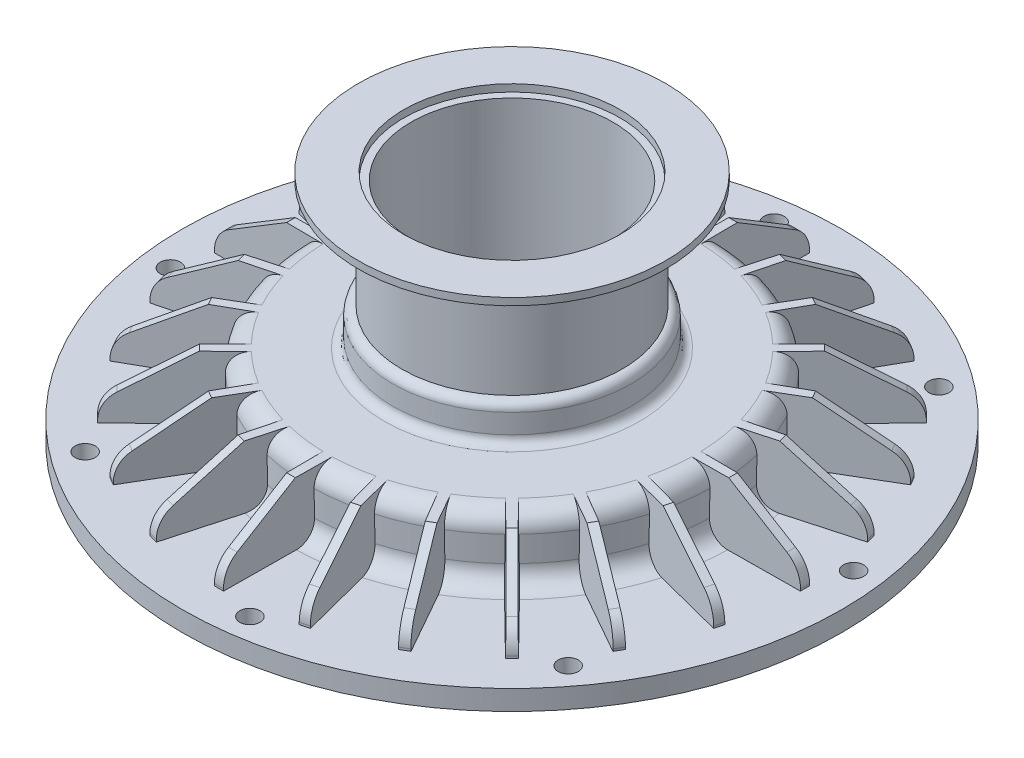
SolidWorks part; units mm, degrees
ref_plane "Ön Düzlem" through (0, 0, 0) normal (0, 0, 1) x (1, 0, 0)
ref_plane "Üst Düzlem" through (0, 0, 0) normal (0, 1, 0) x (1, 0, 0)
ref_plane "Sağ Düzlem" through (0, 0, 0) normal (1, 0, 0) x (0, 0, -1)
sketch "Çizim1" plane through (0, 0, 0) normal (1, 0, 0) x (0, 0, -1)
  line L0 (0, 0) -> (0, 56.1194) construction
  line L1 (-10, 35.35) -> (-70.25, 35.35)
  line L2 (-70.25, 35.35) -> (-70.25, 13.85)
  line L3 (-70.25, 13.85) -> (-114.25, 13.85)
  line L4 (-114.25, 13.85) -> (-114.25, 6.925)
  line L5 (-114.25, 6.925) -> (-101.55, 6.925)
  line L6 (-101.55, 6.925) -> (-101.55, 0)
  line L7 (-101.55, 0) -> (-20.05, 0)
  line L8 (-20.05, 0) -> (-20.05, 6.35)
  line L9 (-20.05, 6.35) -> (-16.88, 6.35)
  line L10 (-16.88, 6.35) -> (-16.88, 25.35)
  line L11 (-16.88, 25.35) -> (-10, 25.35)
  line L12 (-10, 25.35) -> (-10, 35.35)
  dimension "D1" = 10
  dimension "D2" = 60.25
  dimension "D3" = 21.5
  dimension "D4" = 10
  dimension "D5" = 19
  dimension "D6" = 6.35
  dimension "D7" = 81.5
  dimension "D8" = 44
  dimension "D9" = 12.7
  dimension "D10" = 3.17
revolve "Döndür1" add sketch "Çizim1" angle 360 about L0
sketch "Çizim2" plane through (0, 13.85, 0) normal (0, 1, 0) x (1, 0, 0)
  line L0 (0, 0) -> (114.25, 0) construction
  line L1 (0, 0) -> (113.2726, 14.9126) construction
  circle A0 centre (104.5974, 13.7705) radius 3.5
  circle A1 centre (0, 0) radius 114.25 construction
  dimension "D1" = 7
  dimension "D2" = 7.5
  dimension "D3" = 105.5
extrude "Kes-Ekstrüzyon1" cut sketch "Çizim2" against normal through all
pattern_circular "Dairesel Kaplama1" count 8 over 360 about axis through (0, 0, 0) along (0, 1, 0) of "Kes-Ekstrüzyon1"
fillet "Radyus1" radius 6.35 2 edges at (0, 13.85, -70.25) (0, 35.35, -70.25)
sketch "Çizim3" plane through (0, 0, 0) normal (0, 0, 1) x (1, 0, 0)
  line L0 (70.25, 20.2) -> (70.25, 29) construction
  line L1 (70.25, 20.2) -> (70.25, 29) construction
  line L2 (63.9, 35.35) -> (76.6, 35.35)
  line L3 (76.6, 35.35) -> (101.55, 20.2)
  line L4 (101.55, 20.2) -> (101.55, 13.85)
  line L5 (114.25, 13.85) -> (-114.25, 13.85) construction
  line L6 (101.55, 13.85) -> (76.6, 13.85) construction
  line L7 (114.25, 6.925) -> (114.25, 13.85) construction
  arc A0 (70.25, 29) -> (63.9, 35.35) centre (63.9, 29) ccw construction
  arc A1 (70.25, 20.2) -> (76.6, 13.85) centre (76.6, 20.2) ccw construction
  arc A2 (70.25, 29) -> (63.9, 35.35) centre (63.9, 29) ccw construction
  arc A3 (70.25, 20.2) -> (76.6, 13.85) centre (76.6, 20.2) ccw construction
  dimension "D1" = 6.35
  dimension "D2" = 12.7
  dimension "D3" = 12.7
rib "Feder1" sketch "Çizim3" sketch "Çizim3" thickness 3 extrusion direction parallel to sketch draft on yes draft angle 1 parameters "D1"=3, "D3"=1
fillet "Radyus2" radius 10 1 edges at (101.55, 20.2, 0)
pattern_circular "Dairesel Kaplama2" count 24 over 360 about axis through (0, 0, 0) along (0, 1, 0) of "Radyus2", "Feder1"
sketch "Çizim4" plane through (0, 35.35, 0) normal (0, 1, 0) x (1, 0, 0)
  circle A0 centre (0, 0) radius 41.25
  dimension "D1" = 82.5
extrude "Yükseklik-Ekstrüzyon1" add sketch "Çizim4" along normal blind 12.7
fillet "Radyus3" radius 3 2 edges at (0, 35.35, -41.25) (0, 48.05, 41.25)
sketch "Çizim5" plane through (0, 48.05, 0) normal (0, 1, 0) x (1, 0, 0)
  circle A0 centre (0, 0) radius 35
  dimension "D1" = 70
extrude "Kes-Ekstrüzyon2" cut sketch "Çizim5" against normal through all
sketch "Çizim6" plane through (0, 0, 0) normal (0, -1, 0) x (1, 0, 0)
  circle A0 centre (0, 0) radius 56.8
  dimension "D1" = 113.6
extrude "Kes-Ekstrüzyon3" cut sketch "Çizim6" against normal blind 25.4
sketch "Çizim7" plane through (0, 48.05, 0) normal (0, 1, 0) x (1, 0, 0)
  circle A0 centre (0, 0) radius 38.25 construction
  circle A1 centre (0, 0) radius 38.25
  circle A2 centre (0, 0) radius 35 construction
  circle A3 centre (0, 0) radius 35
extrude "Yükseklik-Ekstrüzyon2" add sketch "Çizim7" along normal blind 40
sketch "Çizim8" plane through (0, 0, 0) normal (1, 0, 0) x (0, 0, -1)
  line L0 (0, 0) -> (0, 131.3157) construction
  line L2 (38.25, 88.05) -> (53.25, 88.05)
  line L3 (53.25, 88.05) -> (53.25, 85.55)
  line L4 (53.25, 85.55) -> (40.1878, 82.05)
  line L5 (40.1878, 82.05) -> (40.1878, 78.05)
  line L6 (40.1878, 78.05) -> (38.25, 78.05)
  line L7 (38.25, 48.05) -> (38.25, 88.05) construction
  line L8 (38.25, 78.05) -> (38.25, 88.05)
  dimension "D1" = 10
  dimension "D2" = 15
  dimension "D3" = 2.5
  dimension "D4" = 4
  dimension "D5" = 15
revolve "Döndür2" add sketch "Çizim8" angle 360 about L0
sketch "Çizim9" plane through (0, 88.05, 0) normal (0, 1, 0) x (1, 0, 0)
  circle A0 centre (0, 0) radius 35 construction
  circle A1 centre (0, 0) radius 35
  circle A2 centre (0, 0) radius 37.5
  dimension "D1" = 2.5
extrude "Kes-Ekstrüzyon4" cut sketch "Çizim9" against normal blind 2.5
